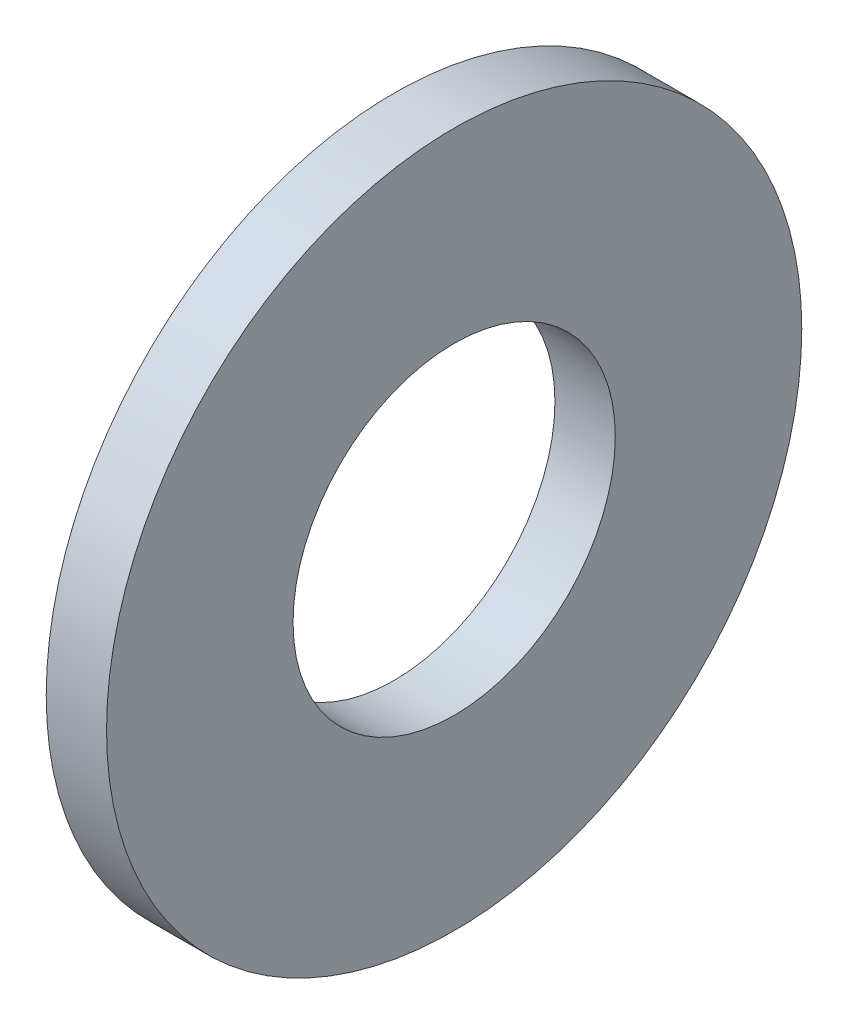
SolidWorks part; units mm, degrees
ref_plane "Front Plane" through (0, 0, 0) normal (0, 0, 1) x (1, 0, 0)
ref_plane "Top Plane" through (0, 0, 0) normal (0, 1, 0) x (1, 0, 0)
ref_plane "Right Plane" through (0, 0, 0) normal (1, 0, 0) x (0, 0, -1)
sketch "Sketch1" plane through (0, 0, 0) normal (1, 0, 0) x (0, 0, -1)
  circle A0 centre (0, 0) radius 5.5626
  circle A1 centre (0, 0) radius 2.5781
  dimension "OD" = 11.1252
  dimension "ID" = 5.1562
extrude "Boss-Extrude1" add sketch "Sketch1" along normal blind 0.9652
